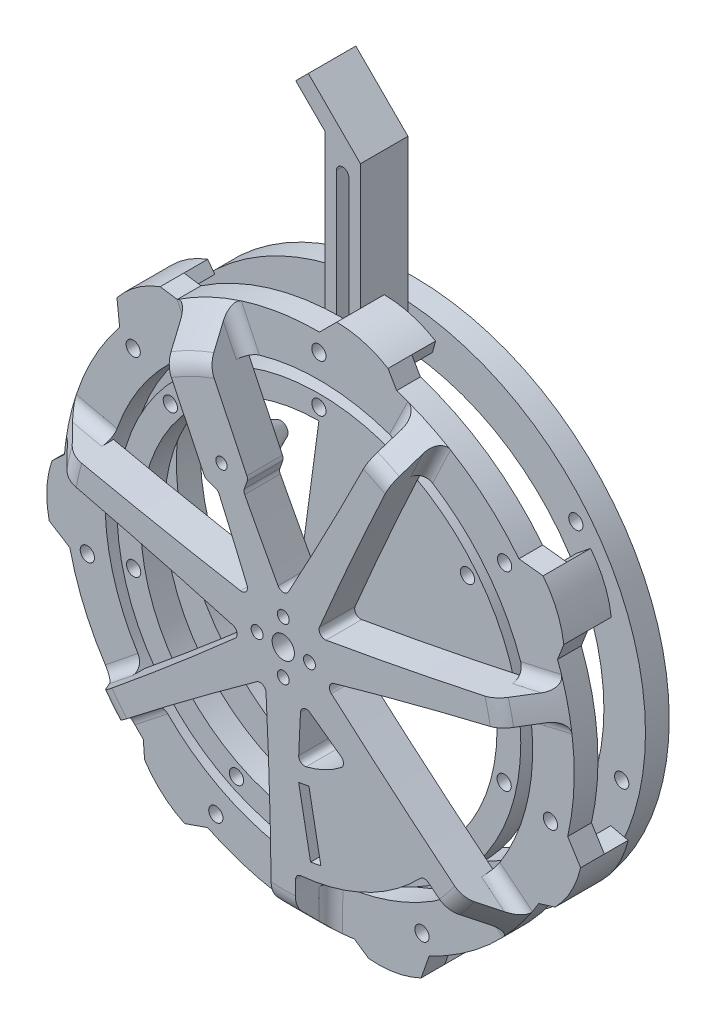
SolidWorks part; units mm, degrees
other "<outer>-<Cut-Extrude4>"
other "<outer>-<Boss-Extrude1[1]>"
other "<outer>-<Boss-Extrude2>"
other "<outer>-<LPattern1>"
ref_plane "Front Plane" through (0, 0, 0) normal (0, 0, 1) x (1, 0, 0)
ref_plane "Top Plane" through (0, 0, 0) normal (0, 1, 0) x (1, 0, 0)
ref_plane "Right Plane" through (0, 0, 0) normal (1, 0, 0) x (0, 0, -1)
mirrored part "outer_Mirrored"
